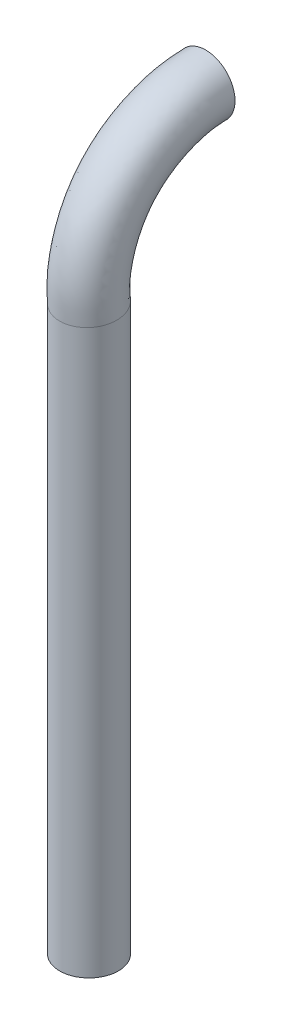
SolidWorks part; units mm, degrees
ref_plane "Plan de face" through (0, 0, 0) normal (0, 0, 1) x (1, 0, 0)
ref_plane "Plan de dessus" through (0, 0, 0) normal (0, 1, 0) x (1, 0, 0)
ref_plane "Plan de droite" through (0, 0, 0) normal (1, 0, 0) x (0, 0, -1)
sketch "Esquisse1" plane through (0, 0, 0) normal (0, 0, 1) x (1, 0, 0)
  line L0 (0, 12) -> (0, 0) construction
  circle A0 centre (0, 12) radius 0.5
  dimension "D1" = 1
  dimension "D2" = 12
sketch "Esquisse6" plane through (0, 0, 0) normal (1, 0, 0) x (0, 0, -1)
  line L0 (0, 12) -> (0, 0) construction
  line L1 (-1.9869, 9.7715) -> (-1.9869, 0.1573)
  arc A0 (-1.9869, 9.7715) -> (0, 12) centre (0, 10) cw
  dimension "D1" = 2
sweep "Balayage1" add profiles "Esquisse1" path "Esquisse6"
